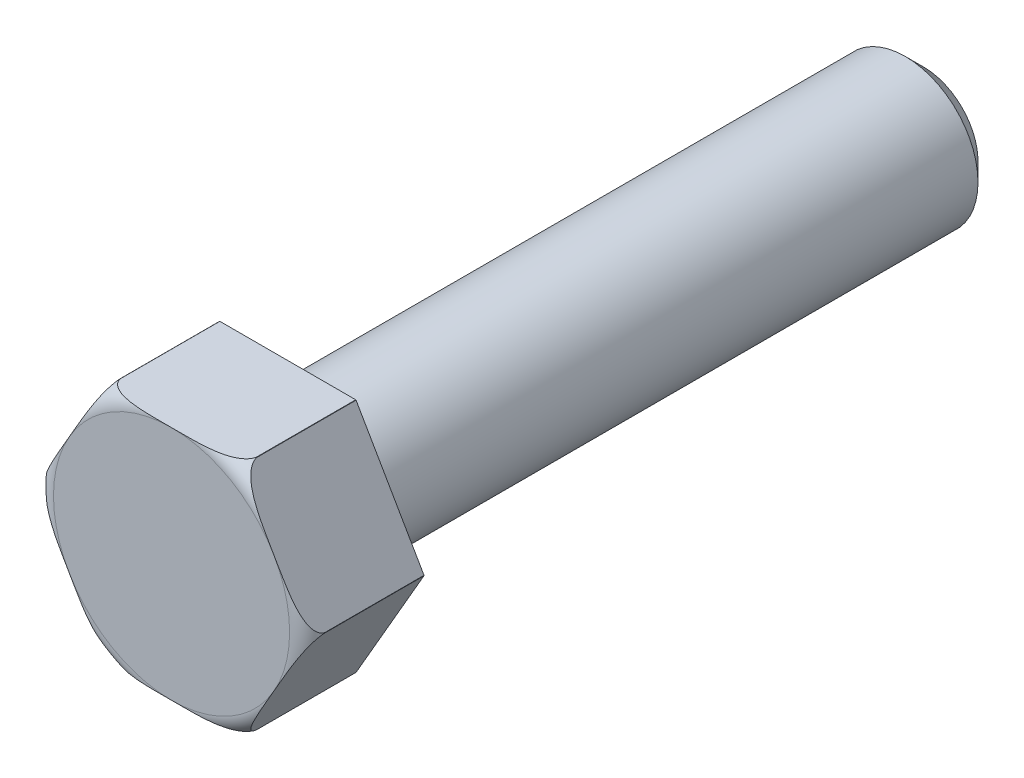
SolidWorks part; units mm, degrees
ref_plane "Plan1" through (0, 0, 0) normal (0, 0, 1) x (1, 0, 0)
ref_plane "Plan2" through (0, 0, 0) normal (0, 1, 0) x (1, 0, 0)
ref_plane "Plan3" through (0, 0, 0) normal (1, 0, 0) x (0, 0, -1)
sketch "Esquisse1" plane through (0, 0, 0) normal (0, 0, 1) x (1, 0, 0)
  circle A0 centre (0, 0) radius 7.5
  dimension "D1" = 15
extrude "Extrusion1" add sketch "Esquisse1" along normal blind 6.4
fillet "Congé1" radius 1
sketch "Esquisse2" plane through (0, 0, 6.4) normal (0, 0, 1) x (1, 0, 0)
  line L1 (7.5056, 0) -> (3.7528, 6.5)
  line L2 (3.7528, 6.5) -> (-3.7528, 6.5)
  line L3 (-3.7528, 6.5) -> (-7.5056, 0)
  line L4 (-7.5056, 0) -> (-3.7528, -6.5)
  line L5 (-3.7528, -6.5) -> (3.7528, -6.5)
  line L6 (3.7528, -6.5) -> (7.5056, 0)
  circle A0 centre (0, 0) radius 6.5 construction
  circle A1 centre (0, 0) radius 14.1421
  dimension "D1" = 13
extrude "Enlèv. mat.-Extru.1" cut sketch "Esquisse2" against normal through all
sketch "Esquisse3" plane through (0, 0, 0) normal (0, 0, -1) x (-1, 0, 0)
  circle A0 centre (0, 0) radius 4
  dimension "D1" = 8
extrude "Extrusion2" add sketch "Esquisse3" along normal blind 35
chamfer "Chanfrein1" distance 1 angle 45
